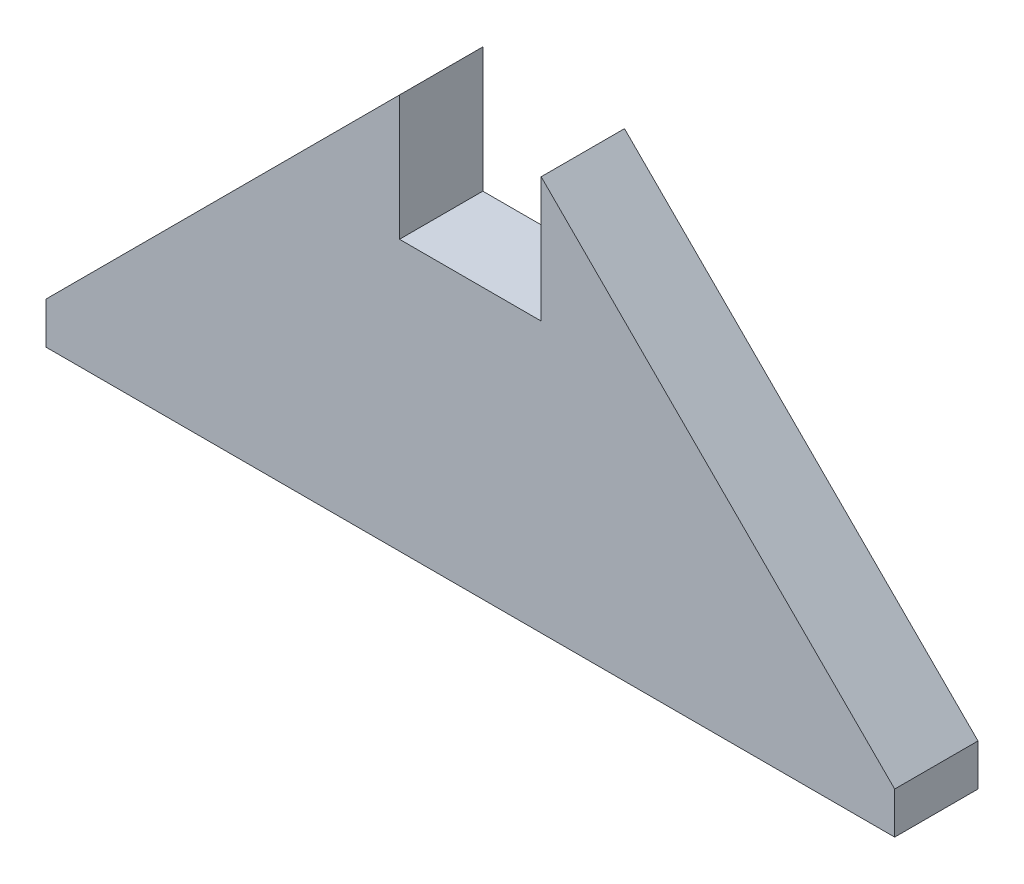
SolidWorks part; units mm, degrees
ref_plane "Ebene vorne" through (0, 0, 0) normal (0, 0, 1) x (1, 0, 0)
ref_plane "Ebene oben" through (0, 0, 0) normal (0, 1, 0) x (1, 0, 0)
ref_plane "Ebene rechts" through (0, 0, 0) normal (1, 0, 0) x (0, 0, -1)
sketch "Skizze1" plane through (0, 0, 0) normal (0, 0, 1) x (1, 0, 0)
  line L0 (0, 0) -> (0, -5)
  line L1 (0, -5) -> (101.8528, -5)
  line L2 (0, 0) -> (42.4264, 42.4264)
  line L3 (101.8528, -5) -> (101.8528, 0)
  line L4 (101.8528, 0) -> (59.4264, 42.4264)
  line L5 (42.4264, 42.4264) -> (42.4264, 27.4264)
  line L6 (42.4264, 27.4264) -> (59.4264, 27.4264)
  line L7 (59.4264, 27.4264) -> (59.4264, 42.4264)
  dimension "D1" = 60
  dimension "D2" = 60
  dimension "D3" = 17
  dimension "D4" = 5
  dimension "D5" = 45
  dimension "D6" = 15
  dimension "D7" = 15
extrude "Aufsatz-Linear austragen1" add sketch "Skizze1" along normal blind 10
